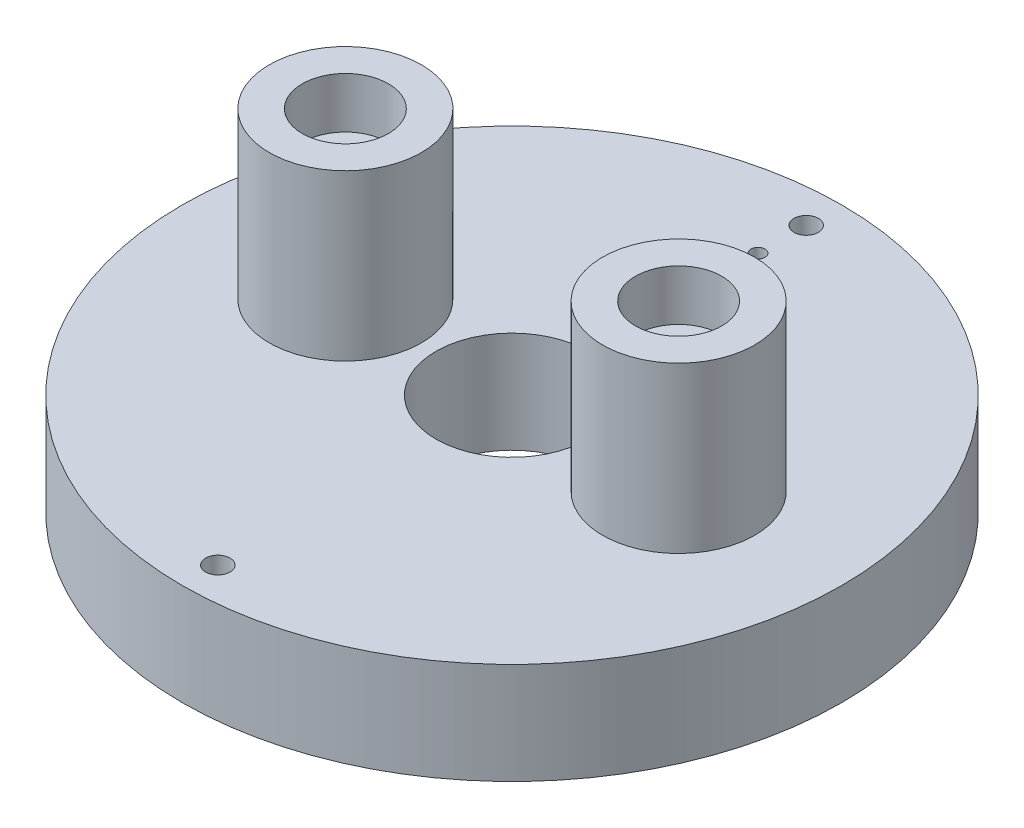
SolidWorks part; units mm, degrees
ref_plane "Front Plane" through (0, 0, 0) normal (0, 0, 1) x (1, 0, 0)
ref_plane "Top Plane" through (0, 0, 0) normal (0, 1, 0) x (1, 0, 0)
ref_plane "Right Plane" through (0, 0, 0) normal (1, 0, 0) x (0, 0, -1)
sketch "Sketch1" plane through (0, 0, 0) normal (0, 1, 0) x (1, 0, 0)
  line L0 (32.5, 0) -> (-32.5, 0) construction
  circle A0 centre (0, 0) radius 32.5
  circle A1 centre (0, 0) radius 7.5
  dimension "D1" = 65
  dimension "D2" = 15
extrude "Boss-Extrude1" add sketch "Sketch1" along normal blind 10
sketch "Sketch2" plane through (0, 10, 0) normal (0, 1, 0) x (1, 0, 0)
  circle A0 centre (16.425, 0) radius 7.5
  circle A1 centre (-16.425, 0) radius 7.5
  dimension "D1" = 15
  dimension "D2" = 15
  dimension "D3" = 16.425
  dimension "D4" = 16.425
extrude "Boss-Extrude2" add sketch "Sketch2" along normal blind 11.25
sketch "Sketch4" plane through (0, 0, 0) normal (0, -1, 0) x (1, 0, 0)
  circle A0 centre (0, -24.25) radius 0.7
  point P0 (0, 29)
  point P1 (0, -29)
  point P3 (0, -24.25)
  dimension "D4" = 1.4
  dimension "D1" = 24.25
  dimension "D2" = 29
  dimension "D3" = 29
extrude "Cut-Extrude1" cut sketch "Sketch4" against normal blind 10
hole_wizard "CBORE for M2 SHCS1" positions "Sketch9" profile "Sketch10" counterbore size "M2" standard "ANSI Metric"
sketch "Sketch9" plane through (0, 0, 0) normal (0, -1, 0) x (-1, 0, 0)
  point P0 (0, -29)
  point P3 (0, 29)
sketch "Sketch10" plane through (0, 0, 29) normal (1, 0, 0) x (0, 0, -1)
  line L0 (0, 0) -> (0, 10)
  line L1 (0, 10) -> (1.2, 10)
  line L3 (1.2, 10) -> (1.2, 8)
  line L4 (1.2, 8) -> (2.2, 8)
  line L5 (2.2, 8) -> (2.2, 0)
  line L7 (2.2, 0) -> (0, 0)
  line L11 (0, -6.35) -> (0, 107.95) construction
  dimension "Thru Hole Dia." = 2.4
  dimension "Thru Hole Depth" = 10
  dimension "C'Bore Dia." = 4.4
  dimension "C'Bore Depth" = 8
sketch "Sketch12" plane through (0, 21.25, 0) normal (0, 1, 0) x (1, 0, 0)
  circle A0 centre (-16.425, 0) radius 7.5
  circle A1 centre (-16.425, 0) radius 4.25
  circle A2 centre (16.425, 0) radius 7.5
  circle A3 centre (16.425, 0) radius 4.25
  point P0 (-16.425, 0)
  point P1 (16.425, 0)
  dimension "D1" = 8.5
  dimension "D2" = 8.5
extrude "Boss-Extrude3" add sketch "Sketch12" along normal blind 5
